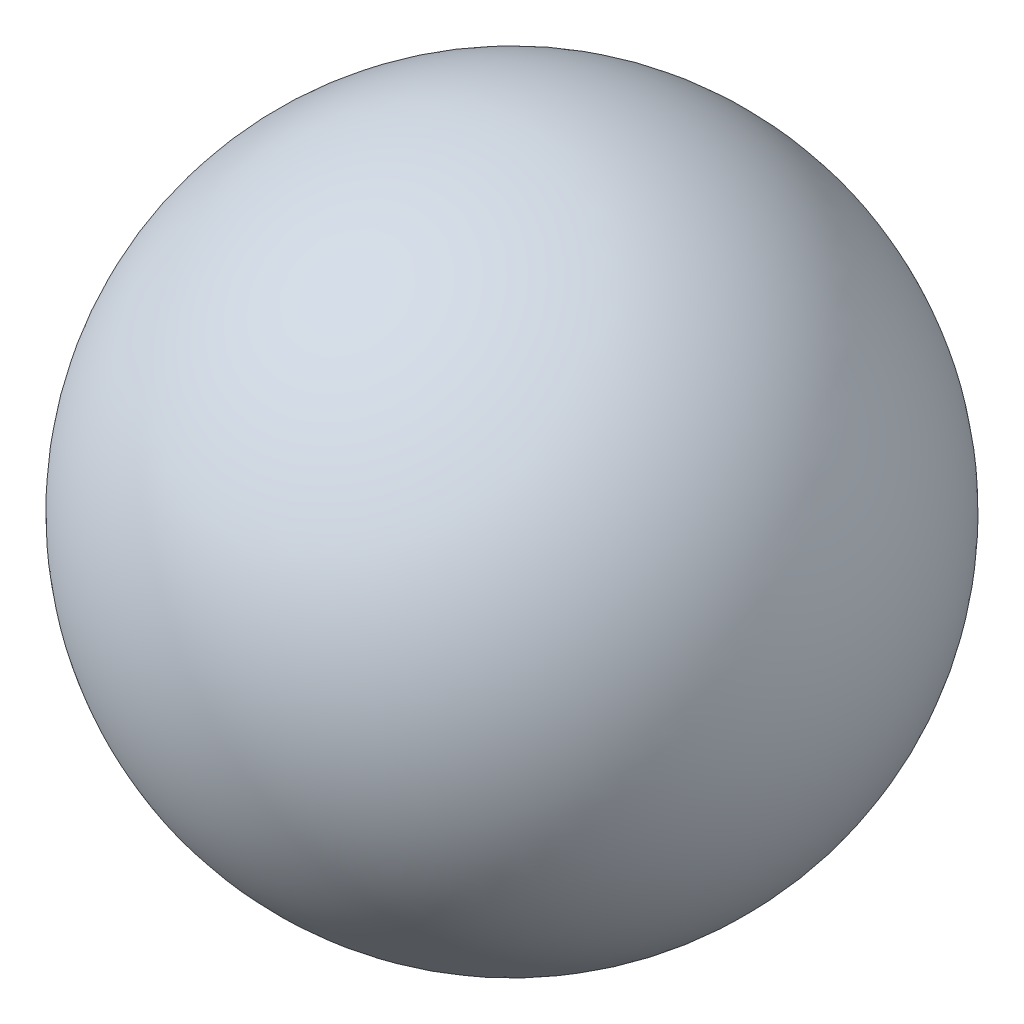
SolidWorks part; units mm, degrees
ref_plane "정면" through (0, 0, 0) normal (0, 0, 1) x (1, 0, 0)
ref_plane "윗면" through (0, 0, 0) normal (0, 1, 0) x (1, 0, 0)
ref_plane "우측면" through (0, 0, 0) normal (1, 0, 0) x (0, 0, -1)
sketch "스케치1" plane through (0, 0, 0) normal (0, 1, 0) x (1, 0, 0)
  line L0 (0, 33.5) -> (0, -33.5) construction
  circle A0 centre (0, 0) radius 33.5
  circle A1 centre (0, 0) radius 30
  dimension "D1" = 67
  dimension "D2" = 60
revolve "회전2" add sketch "스케치1" angle 360 about L0
